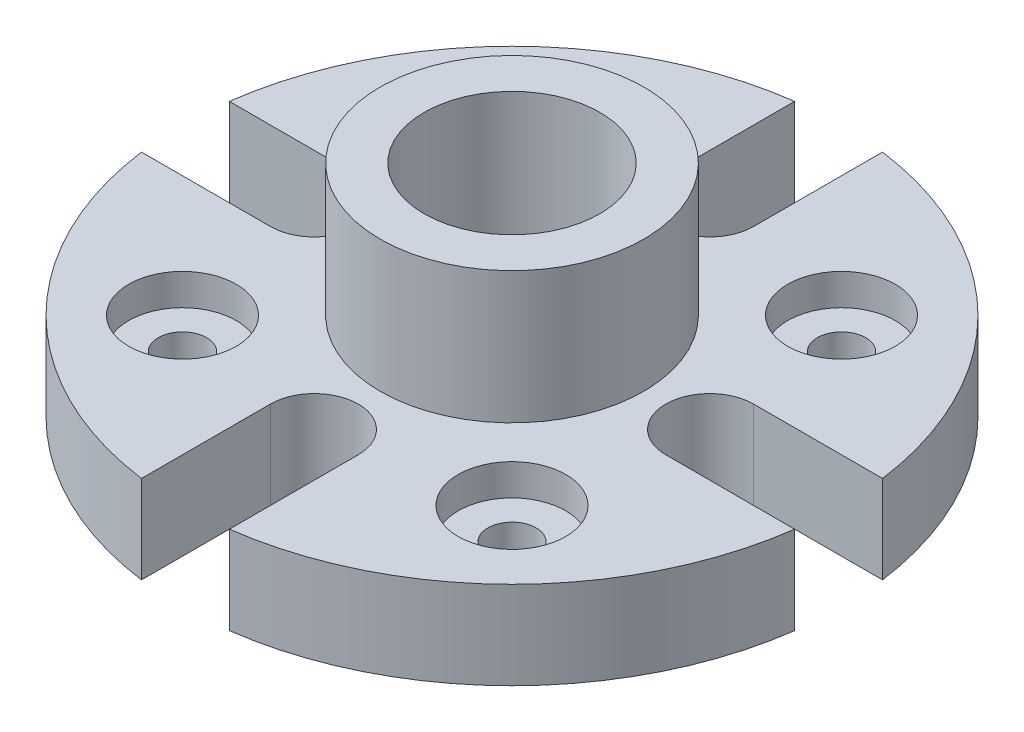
SolidWorks part; units mm, degrees
ref_plane "Front Plane" through (0, 0, 0) normal (0, 0, 1) x (1, 0, 0)
ref_plane "Top Plane" through (0, 0, 0) normal (0, 1, 0) x (1, 0, 0)
ref_plane "Right Plane" through (0, 0, 0) normal (1, 0, 0) x (0, 0, -1)
sketch "Sketch1" plane through (0, 0, 0) normal (0, 1, 0) x (1, 0, 0)
  circle A0 centre (0, 0) radius 37.5
  dimension "D1" = 75
extrude "Extrude1" add sketch "Sketch1" along normal blind 10
sketch "Sketch2" plane through (0, 10, 0) normal (0, 1, 0) x (-1, 0, 0)
  line L0 (0, 0) -> (0, -37.5) construction
  line L1 (5, -37.1652) -> (5, -22.5)
  line L2 (-5, -37.1652) -> (-5, -22.5)
  circle A0 centre (0, 0) radius 37.5 construction
  arc A1 (5, -22.5) -> (-5, -22.5) centre (0, -22.5) ccw
  arc A2 (-5, -37.1652) -> (5, -37.1652) centre (0, 0) ccw
  dimension "D1" = 5
  dimension "D2" = 15
sketch "Sketch3" plane through (0, 10, 0) normal (0, 1, 0) x (-1, 0, 0)
  circle A0 centre (0, 0) radius 15
  circle A1 centre (0, 0) radius 10
  dimension "D1" = 30
  dimension "D2" = 20
extrude "Extrude3" add sketch "Sketch3" along normal blind 15
extrude "Cut-Extrude1" cut sketch "Sketch2" against normal blind 10
hole_wizard "CBORE for M5 Hex Head Bolt1" positions "Sketch5" profile "Sketch6" counterbore size "M5" standard "Ansi Metric"
sketch "Sketch5" plane through (0, 10, 0) normal (0, 1, 0) x (-1, 0, 0)
  line L0 (0, 0) -> (37.5, 0) construction
  line L1 (0, 0) -> (0, -37.5) construction
  line L2 (37.5, 0) -> (0, -37.5) construction
  arc A0 (5, -37.1652) -> (-5, -37.1652) centre (0, 0) ccw construction
  point P0 (18.75, -18.75)
sketch "Sketch6" plane through (-18.75, 10, -18.75) normal (1, 0, 0) x (0, 0, 1)
  line L0 (0, 0) -> (0, 10)
  line L1 (0, 10) -> (2.75, 10)
  line L3 (2.75, 10) -> (2.75, 3.58)
  line L4 (2.75, 3.58) -> (6.12, 3.58)
  line L5 (6.12, 3.58) -> (6.12, 0)
  line L7 (6.12, 0) -> (0, 0)
  line L11 (0, -6.35) -> (0, 107.95) construction
  dimension "Thru Hole Dia." = 5.5
  dimension "Thru Hole Depth" = 10
  dimension "C'Bore Dia." = 12.24
  dimension "C'Bore Depth" = 3.58
pattern_circular "CirPattern1" count 4 over 360 about axis through (0, 0, 0) along (0, 1, 0) of "Cut-Extrude1", "CBORE for M5 Hex Head Bolt1"
sketch "Sketch7" plane through (0, 10, 0) normal (0, 1, 0) x (-1, 0, 0)
  circle A1 centre (0, 0) radius 10
  circle A2 centre (0, 0) radius 10
  dimension "D1" = 0
extrude "Cut-Extrude2" cut sketch "Sketch7" against normal blind 10
